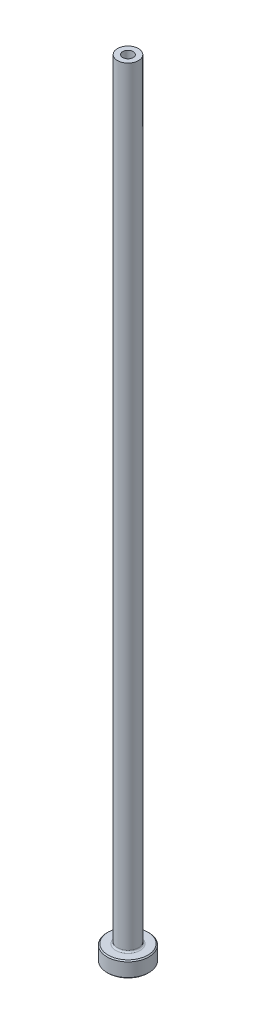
SolidWorks part; units mm, degrees
ref_plane "Front Plane" through (0, 0, 0) normal (0, 0, 1) x (1, 0, 0)
ref_plane "Top Plane" through (0, 0, 0) normal (0, 1, 0) x (1, 0, 0)
ref_plane "Right Plane" through (0, 0, 0) normal (1, 0, 0) x (0, 0, -1)
sketch "Sketch1" plane through (0, 0, 0) normal (0, 0, 1) x (1, 0, 0)
  line L0 (-1, 150) -> (-2, 150)
  line L1 (-2, 150) -> (-2, 3)
  line L2 (-2, 3) -> (-4, 3)
  line L3 (-4, 3) -> (-4, 0)
  line L4 (4.4, 0) -> (-4.4, 0) construction
  line L5 (-4, 0) -> (-1.25, 0)
  line L6 (-1, 115) -> (-1, 150)
  line L7 (0, 92.1877) -> (0, -15.5353) construction
  line L8 (0, -4.4) -> (0, 4.4) construction
  line L9 (-1, 115) -> (-1.25, 103)
  line L10 (-1.25, 103) -> (-1.25, 0)
  dimension "D1" = 0.25
  dimension "ID" = 2
  dimension "OD" = 4
  dimension "L" = 150
  dimension "H" = 8
  dimension "T" = 3
  dimension "N" = 35
  dimension "D2" = 12
revolve "Revolve1" add sketch "Sketch1" angle 360 about L7
fillet "Fillet1" radius 0.3 1 edges at (0, 3, 2)
chamfer "Chamfer1" distance 0.2 angle 45 2 edges at (0, 3, 4) (0, 0, 4)
chamfer "Chamfer3" distance 0.5 angle 45 1 edges at (0, 0, 1.25)
